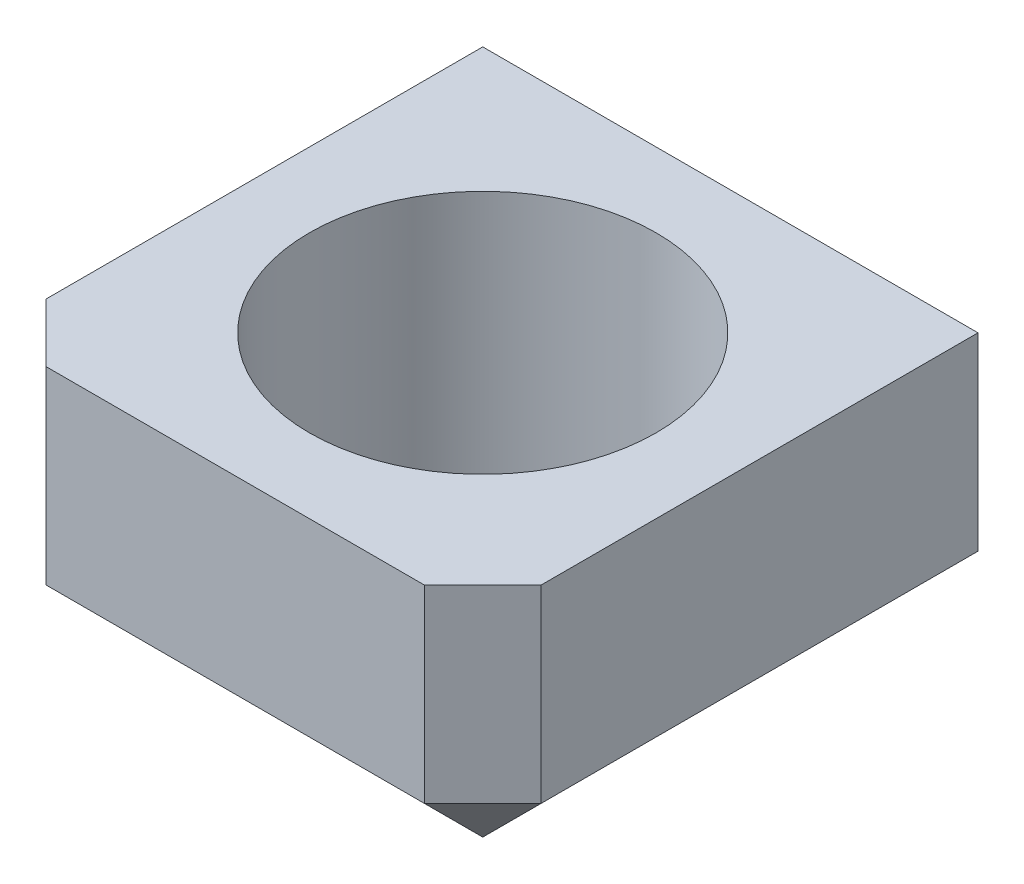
SolidWorks part; units mm, degrees
ref_plane "Front Plane" through (0, 0, 0) normal (0, 0, 1) x (1, 0, 0)
ref_plane "Top Plane" through (0, 0, 0) normal (0, 1, 0) x (1, 0, 0)
ref_plane "Right Plane" through (0, 0, 0) normal (1, 0, 0) x (0, 0, -1)
sketch "Sketch1" plane through (0, 0, 0) normal (0, 1, 0) x (1, 0, 0)
  line L1 (-63.5, -63.5) -> (63.5, -63.5)
  line L2 (-63.5, -63.5) -> (-63.5, 63.5)
  line L3 (-63.5, 63.5) -> (63.5, 63.5)
  line L4 (63.5, -63.5) -> (63.5, 63.5)
  line L5 (-63.5, -63.5) -> (63.5, 63.5) construction
  line L6 (-63.5, 63.5) -> (63.5, -63.5) construction
  circle A0 centre (0, 0) radius 44.45
  point P0 (0, 0)
  dimension "D3" = 88.9
  dimension "D1" = 127
  dimension "D2" = 127
extrude "Boss-Extrude1" add sketch "Sketch1" against normal blind 63.5
chamfer "Chamfer1" distance 15 angle 45 5 edges at (-63.5, -63.5, 0) (63.5, -63.5, 0) (63.5, -31.75, 63.5) (0, -63.5, 63.5) (-63.5, -31.75, 63.5)
